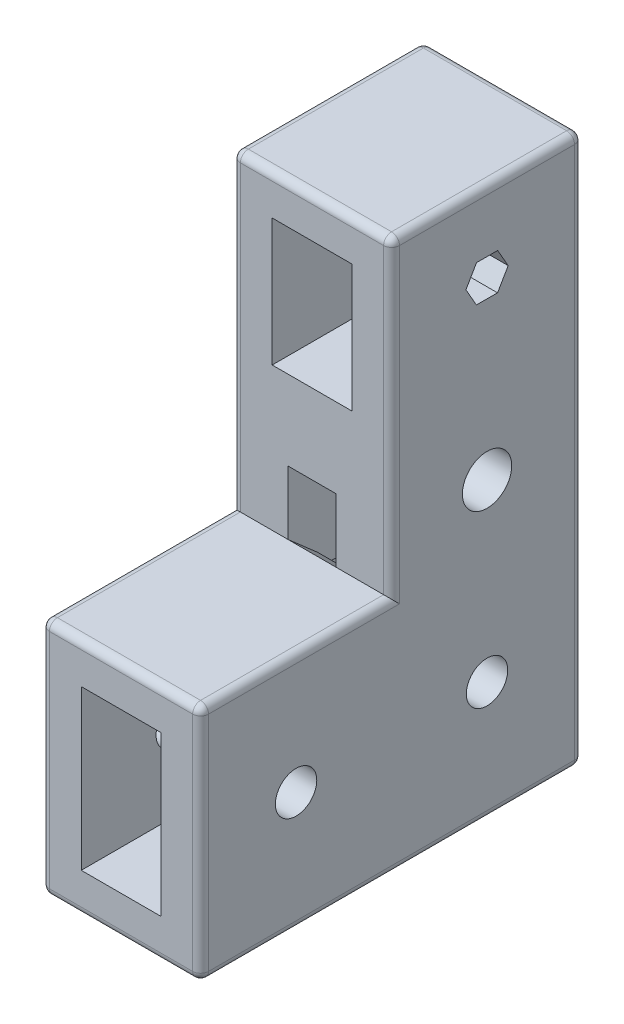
SolidWorks part; units mm, degrees
ref_plane "正面" through (0, 0, 0) normal (1, 0, 0) x (0, 1, 0)
ref_plane "平面" through (0, 0, 0) normal (0, 0, 1) x (0, 1, 0)
ref_plane "右側面" through (0, 0, 0) normal (0, 1, 0) x (-1, 0, 0)
sketch "ｽｹｯﾁ1" plane through (0, 0, 0) normal (1, 0, 0) x (0, 1, 0)
  line L0 (-35.2119, 29.3532) -> (-35.2119, -18.6468)
  line L1 (-35.2119, -18.6468) -> (33.7881, -18.6468)
  line L2 (33.7881, -18.6468) -> (33.7881, 5.3532)
  line L3 (33.7881, 5.3532) -> (-5.2119, 5.3532)
  line L4 (-5.2119, 5.3532) -> (-5.2119, 29.3532)
  line L5 (-5.2119, 29.3532) -> (-35.2119, 29.3532)
  dimension "D1" = 69
  dimension "D2" = 48
  dimension "D3" = 24
  dimension "D4" = 30
extrude "ﾎﾞｽ - 押し出し1" add sketch "ｽｹｯﾁ1" along normal blind 20
sketch "ｽｹｯﾁ2" plane through (20, 0, 0) normal (1, 0, 0) x (0, 1, 0)
  line L0 (-5.2119, 29.3532) -> (-35.2119, 29.3532) construction
  line L1 (33.7881, 5.3532) -> (-5.2119, 5.3532) construction
  line L2 (-35.2119, 29.3532) -> (-35.2119, -18.6468) construction
  line L3 (26.0833, -7.983) -> (26.0929, -5.3272)
  line L4 (26.0929, -5.3272) -> (23.7977, -3.991)
  line L5 (23.7977, -3.991) -> (21.4929, -5.3107)
  line L6 (21.4929, -5.3107) -> (21.4833, -7.9664)
  line L7 (21.4833, -7.9664) -> (23.7785, -9.3026)
  line L8 (23.7785, -9.3026) -> (26.0833, -7.983)
  circle A0 centre (-20.2119, 17.3532) radius 2.6
  circle A1 centre (-20.2119, -6.6468) radius 2.6
  circle A4 centre (1.7881, -6.6468) radius 3.1
  circle A5 centre (23.7881, -6.6468) radius 2.3 construction
  dimension "D1" = 5.2
  dimension "D2" = 5.2
  dimension "D3" = 6.2
  dimension "D4" = 4.6
  dimension "D5" = 12
  dimension "D6" = 36
  dimension "D7" = 37
  dimension "D8" = 12
  dimension "D9" = 15
  dimension "D10" = 15
  dimension "D11" = 36
  dimension "D12" = 59
extrude "ｶｯﾄ - 押し出し1" cut sketch "ｽｹｯﾁ2" against normal through all
sketch "ｽｹｯﾁ3" plane through (0, 0, 5.3532) normal (0, 0, 1) x (1, 0, 0)
  line L0 (20, -5.2119) -> (0, -5.2119) construction
  line L1 (7, -5.2119) -> (13, -5.2119)
  line L2 (7, -5.2119) -> (7, 2.7881)
  line L3 (7, 2.7881) -> (13, 2.7881)
  line L4 (13, -5.2119) -> (13, 2.7881)
  line L5 (20, 33.7881) -> (20, -5.2119) construction
  dimension "D1" = 6
  dimension "D2" = 7
  dimension "D3" = 8
sketch "ｽｹｯﾁ4" plane through (0, 0, -18.6468) normal (0, 0, -1) x (1, 0, 0)
  line L1 (7, 26.2119) -> (13, 26.2119)
  line L2 (7, 26.2119) -> (7, 14.2119)
  line L3 (7, 14.2119) -> (13, 14.2119)
  line L4 (13, 26.2119) -> (13, 14.2119)
  line L5 (7, 26.2119) -> (13, 14.2119) construction
  line L6 (7, 14.2119) -> (13, 26.2119) construction
  line L7 (20, 35.2119) -> (0, 35.2119) construction
  line L8 (20, 35.2119) -> (20, -33.7881) construction
  point P0 (10, 20.2119)
  dimension "D1" = 15
  dimension "D2" = 6
  dimension "D3" = 7
  dimension "D4" = 12
loft "ｶｯﾄ - ﾛﾌﾄ1" cut profiles "ｽｹｯﾁ4", "ｽｹｯﾁ3"
sketch "ｽｹｯﾁ5" plane through (0, 0, -18.6468) normal (0, 0, -1) x (1, 0, 0)
  line L0 (20, 35.2119) -> (0, 35.2119) construction
  line L1 (5, 30.2119) -> (15, 30.2119)
  line L2 (5, 30.2119) -> (5, 10.2119)
  line L3 (5, 10.2119) -> (15, 10.2119)
  line L4 (15, 30.2119) -> (15, 10.2119)
  line L5 (5, 30.2119) -> (15, 10.2119) construction
  line L6 (5, 10.2119) -> (15, 30.2119) construction
  line L7 (5, -12.7881) -> (15, -12.7881)
  line L8 (5, -12.7881) -> (5, -28.7881)
  line L9 (5, -28.7881) -> (15, -28.7881)
  line L10 (15, -12.7881) -> (15, -28.7881)
  line L11 (5, -12.7881) -> (15, -28.7881) construction
  line L12 (5, -28.7881) -> (15, -12.7881) construction
  line L13 (20, 35.2119) -> (20, -33.7881) construction
  line L14 (20, -33.7881) -> (0, -33.7881) construction
  point P0 (10, 20.2119)
  point P5 (10, -20.7881)
  dimension "D1" = 10
  dimension "D2" = 15
  dimension "D3" = 5
  dimension "D4" = 20
  dimension "D5" = 10
  dimension "D6" = 5
  dimension "D7" = 13
  dimension "D8" = 16
extrude "ｶｯﾄ - 押し出し2" cut sketch "ｽｹｯﾁ5" against normal through all
fillet "ﾌｨﾚｯﾄ1" radius 1 1 edges at (10, -10.2119, -0.3611)
fillet "ﾌｨﾚｯﾄ2" radius 1 17 edges at (0, -0.7119, -18.6468) (10, 33.7881, -18.6468) (0, 33.7881, -6.6468) (10, 33.7881, 5.3532) (20, 33.7881, -6.6468) (20, -0.7119, -18.6468) (20, 14.2881, 5.3532) (20, -5.2119, 17.3532) (0, -5.2119, 17.3532) (0, 14.2881, 5.3532) (10, -35.2119, -18.6468) (20, -35.2119, 5.3532) (0, -35.2119, 5.3532) (20, -20.2119, 29.3532) (10, -35.2119, 29.3532) (0, -20.2119, 29.3532) (10, -5.2119, 29.3532)
